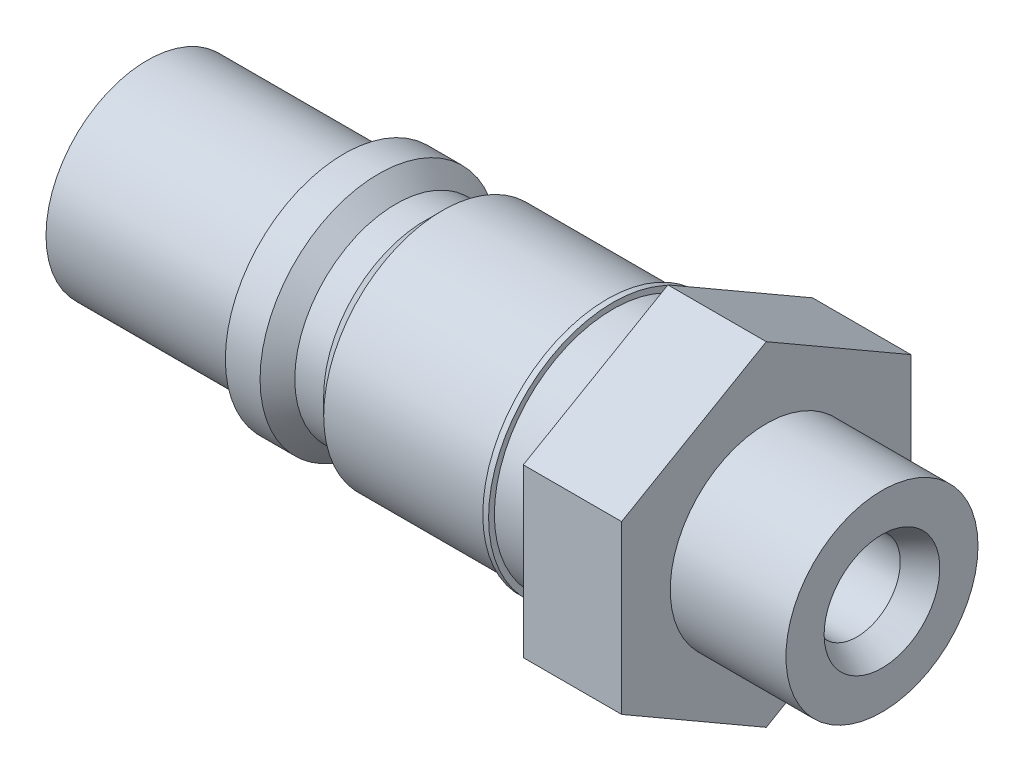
SolidWorks part; units mm, degrees
ref_plane "Alzado" through (0, 0, 0) normal (0, 0, 1) x (1, 0, 0)
ref_plane "Planta" through (0, 0, 0) normal (0, 1, 0) x (1, 0, 0)
ref_plane "Vista lateral" through (0, 0, 0) normal (1, 0, 0) x (0, 0, -1)
sketch "Croquis1" plane through (0, 0, 0) normal (0, 0, 1) x (1, 0, 0)
  line L0 (0, 0) -> (90, 0) construction
  line L1 (0, 0) -> (0, 17.5)
  line L2 (0, 17.5) -> (34, 17.5)
  line L3 (34, 17.5) -> (34, 20.5)
  line L4 (34, 20.5) -> (40, 20.5)
  line L5 (40, 20.5) -> (43, 17.5)
  line L6 (43, 17.5) -> (48, 17.5)
  line L7 (48, 17.5) -> (51, 20.5)
  line L11 (90, 20.5) -> (90, 0)
  line L12 (0, 0) -> (90, 0)
  line L13 (51, 20.5) -> (79.5, 20.5)
  line L14 (79.5, 20.5) -> (79.5, 21.5)
  line L15 (79.5, 21.5) -> (80.5, 21.5)
  line L16 (80.5, 21.5) -> (80.5, 20.5)
  line L17 (80.5, 20.5) -> (90, 20.5)
  dimension "D1" = 35
  dimension "D2" = 90
  dimension "D3" = 28.5
  dimension "D4" = 1
  dimension "D5" = 34
  dimension "D6" = 6
  dimension "D7" = 3
  dimension "D8" = 5
  dimension "D9" = 225
  dimension "D10" = 1
  dimension "D11" = 9.5
revolve "Revolución1" add sketch "Croquis1" angle 360 about L0
sketch "Croquis4" plane through (90, 0, 0) normal (1, 0, 0) x (0, 0, -1)
  line L1 (0, 28.8675) -> (-25, 14.4338)
  line L2 (-25, 14.4338) -> (-25, -14.4338)
  line L3 (-25, -14.4338) -> (0, -28.8675)
  line L4 (0, -28.8675) -> (25, -14.4338)
  line L5 (25, -14.4338) -> (25, 14.4338)
  line L6 (25, 14.4338) -> (0, 28.8675)
  circle A0 centre (0, 0) radius 25 construction
  dimension "D1" = 50
extrude "Saliente-Extruir2" add sketch "Croquis4" along normal blind 17
sketch "Croquis5" plane through (107, 0, 0) normal (1, 0, 0) x (0, 0, -1)
  circle A0 centre (0, 0) radius 16.6
  dimension "D1" = 33.2
extrude "Saliente-Extruir3" add sketch "Croquis5" along normal blind 20
sketch "Croquis6" plane through (0, 0, 0) normal (0, 0, 1) x (1, 0, 0)
  line L0 (0, 0) -> (127, 0) construction
  line L1 (127, -16.6) -> (127, 16.6) construction
  line L2 (0, 0) -> (0, 7.5)
  line L3 (0, 17.5) -> (0, -17.5) construction
  line L4 (0, 7.5) -> (122.6699, 7.5)
  line L5 (122.6699, 7.5) -> (127, 10)
  line L6 (127, 10) -> (127, 0)
  line L7 (0, 0) -> (127, 0)
  dimension "D1" = 30
  dimension "D2" = 10
  dimension "D3" = 15
revolve "Cortar-Revolución1" cut sketch "Croquis6" angle 360 about L0
